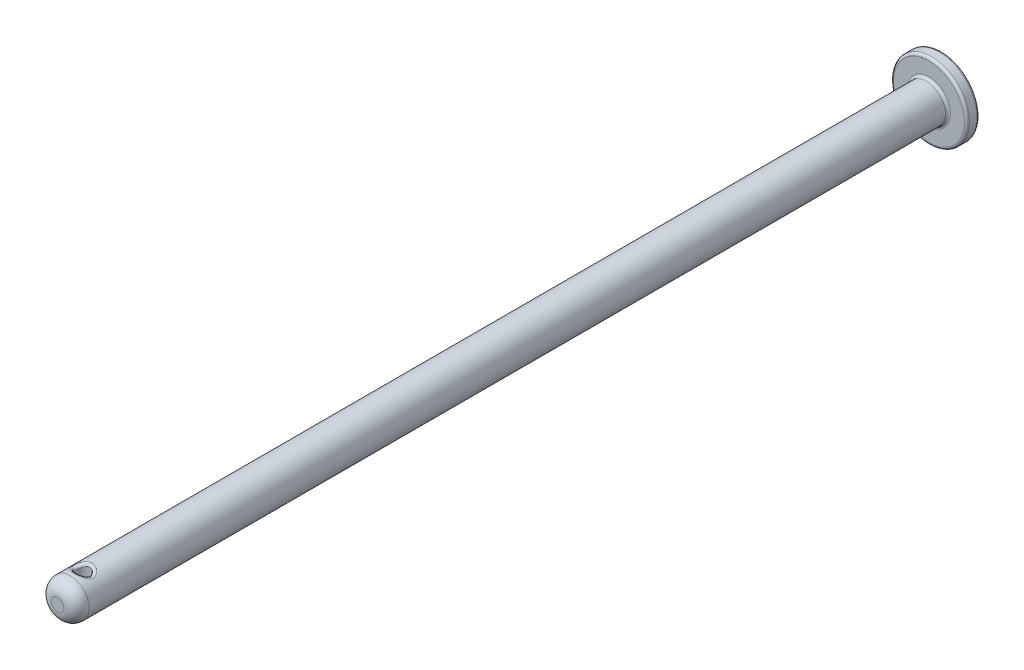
SolidWorks part; units mm, degrees
ref_plane "前基準面" through (0, 0, 0) normal (0, 0, 1) x (1, 0, 0)
ref_plane "上基準面" through (0, 0, 0) normal (0, 1, 0) x (1, 0, 0)
ref_plane "右基準面" through (0, 0, 0) normal (1, 0, 0) x (0, 0, -1)
sketch "草圖1" plane through (0, 0, 0) normal (0, 0, 1) x (1, 0, 0)
  circle A0 centre (0, 0) radius 7.5
  dimension "D1" = 15
extrude "填料-伸長1" add sketch "草圖1" along normal blind 350
fillet "圓角1" radius 5 1 edges at (7.5, 0, 350)
sketch "草圖2" plane through (0, 0, 0) normal (0, 1, 0) x (1, 0, 0)
  line L0 (-2.5, -350) -> (2.5, -350) construction
  line L1 (0, -350) -> (0, 0) construction
  circle A0 centre (0, -340) radius 2.6
  dimension "D2" = 5.2
  dimension "D1" = 10
extrude "除料-伸長1" cut sketch "草圖2" against normal through all and the other way through all
fillet "圓角2" radius 1 1 edges at (7.5, 0, 0)
fillet "圓角3" radius 1 2 edges at (-0.4297, -7.4877, 337.4357) (0.4297, 7.4877, 337.4357)
sketch "草圖3" plane through (0, 0, 0) normal (0, 1, 0) x (1, 0, 0)
  line L0 (0, -350) -> (0, 0) construction
  line L1 (-2.5, -350) -> (2.5, -350) construction
  line L2 (0, -5) -> (-15, -5)
  line L3 (-15, -5) -> (-15, 0)
  line L4 (-15, 0) -> (0, 0)
  line L5 (0, 0) -> (0, -5)
  line L6 (6.5, 0) -> (-6.5, 0) construction
  dimension "D1" = 5
  dimension "D2" = 5
  dimension "D3" = 15
revolve "旋轉1" add sketch "草圖3" angle 360 about L0
fillet "圓角4" radius 1 1 edges at (-7.5, 0, 5)
fillet "圓角5" radius 1 2 edges at (15, 0, 0) (15, 0, 5)
